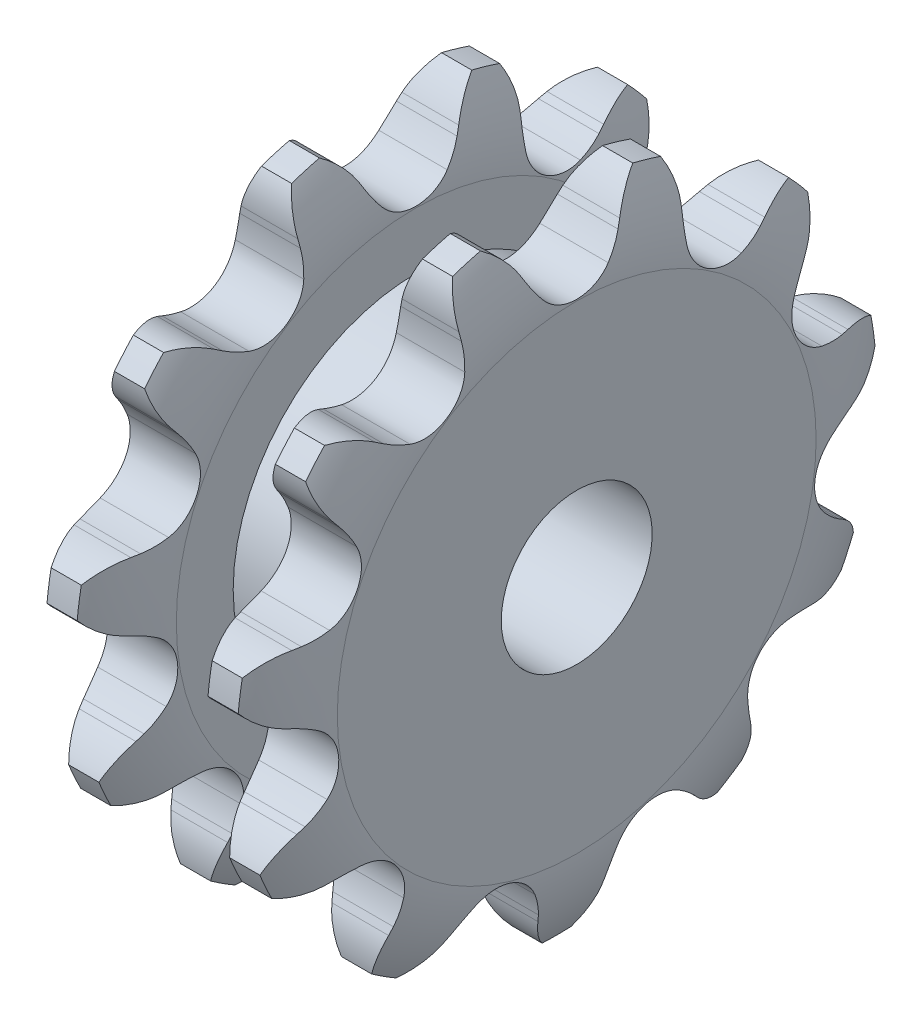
SolidWorks part; units mm, degrees
ref_plane "Plane1" through (0, 0, 0) normal (0, 0, 1) x (1, 0, 0)
ref_plane "Plane2" through (0, 0, 0) normal (0, 1, 0) x (1, 0, 0)
ref_plane "Plane3" through (0, 0, 0) normal (1, 0, 0) x (0, 0, -1)
other "Configuration Table"
sketch "Clipboard" plane through (0, 0, 0) normal (0, 1, 0) x (1, 0, 0)
  line L0 (0, 0) -> (6.2333, -1.2116)
  line L1 (-15, 0) -> (100, 0) construction
  line L2 (0, 0) -> (-0.5301, 0.5991)
  line L3 (0, 0) -> (-2.9891, 1.1425)
  line L4 (0, 0) -> (3.043, 0.5915)
  line L5 (0, 0) -> (-89.0105, -33.1983)
  line L6 (0, 0) -> (-7.6265, -5.1456)
  line L7 (-0.5301, 0.5991) -> (92.0355, 21.9696)
  line L8 (-76.2, 38.1) -> (-75.2, 38.1)
  line L9 (-73.2358, 39.4872) -> (-73.0836, 39.4947)
  line L10 (-73.0533, 76.1892) -> (-66.6533, 76.1892)
  circle A0 centre (0, 0) radius 1.651
  circle A1 centre (0, 0) radius 4
  circle A2 centre (0, 0) radius 4
sketch "BasProSke" plane through (0, 0, 0) normal (0, 1, 0) x (1, 0, 0)
  line L0 (-10, 0) -> (60, 0) construction
  line L1 (0, 0) -> (0, 9.5181)
  line L2 (0, 0) -> (9.2, 0)
  line L3 (9.2, 0) -> (9.2, 9.5181)
  line L4 (8.4, 12.7181) -> (0.8, 12.7181)
  arc A0 (0, 9.5181) -> (0.8, 12.7181) centre (6.8, 9.5181) cw
  arc A1 (9.2, 9.5181) -> (8.4, 12.7181) centre (2.4, 9.5181) ccw
revolve "Base-Revolve" add sketch "BasProSke" angle 360 about L0
sketch "GrvSke" plane through (0, 0, 0) normal (0, 1, 0) x (1, 0, 0)
  line L0 (2.8, 9.5181) -> (2.8, 7.2571)
  line L1 (2.8, 7.2571) -> (6.4, 7.2571)
  line L2 (6.4, 7.2571) -> (6.4, 9.5181)
  line L3 (2, 12.7181) -> (7.2, 12.7181)
  line L4 (4.6, 0) -> (4.6, 52.07) construction
  line L5 (-10, 0) -> (60, 0) construction
  line L6 (0, 0) -> (35.56, 0) construction
  arc A0 (6.4, 9.5181) -> (7.2, 12.7181) centre (13.2, 9.5181) cw
  arc A1 (2.8, 9.5181) -> (2, 12.7181) centre (-4, 9.5181) ccw
revolve "Groove" cut sketch "GrvSke" angle 360 about L6
pattern_linear "Grooves" [suppressed]
sketch "TooCutSke" plane through (0, 0, 0) normal (1, 0, 0) x (0, 0, -1)
  line L0 (1.8371, 10.977) -> (1.9787, 11.2486)
  line L1 (0, 0) -> (0, 107) construction
  line L2 (0, 11.2696) -> (-10, 11.2696) construction
  line L3 (-1.8371, 10.977) -> (-1.9787, 11.2486)
  arc A0 (1.2916, 10.1682) -> (1.8371, 10.977) centre (-2.01, 12.9835) ccw
  arc A1 (1.2916, 10.1682) -> (-1.2916, 10.1682) centre (0, 11.2696) cw
  arc A2 (1.9787, 11.2486) -> (4.4355, 12.7381) centre (4.4355, 9.9672) cw
  arc A3 (-1.2916, 10.1682) -> (-1.8371, 10.977) centre (2.01, 12.9835) cw
  arc A4 (-1.9787, 11.2486) -> (-4.4355, 12.7381) centre (-4.4355, 9.9672) ccw
  arc A5 (4.4355, 12.7381) -> (-4.4355, 12.7381) centre (0, 0) ccw
extrude "ToothCut" cut sketch "TooCutSke" along normal through all
pattern_circular "TeethCuts" count 11 every 32.727 about axis through (-10, 0, 0) along (1, 0, 0) of "ToothCut"
sketch "HubNeaOneSke" plane through (0, 0, 0) normal (-1, 0, 0) x (0, 0, 1)
  circle A0 centre (0, 0) radius 4
extrude "HubNearOne" [suppressed] add sketch "HubNeaOneSke" along normal blind 85.8005
sketch "HubNeaBotSke" plane through (0, 0, 0) normal (-1, 0, 0) x (0, 0, 1)
  circle A0 centre (0, 0) radius 4
extrude "HubNearBoth" [suppressed] add sketch "HubNeaBotSke" along normal blind 42.9002
ref_plane "FarPln" through (9.2, 0, 0) normal (1, 0, 0) x (0, 0, -1)
sketch "HubFarSke" plane through (9.2, 0, 0) normal (1, 0, 0) x (0, 0, -1)
  circle A0 centre (0, 0) radius 4
extrude "HubFar" [suppressed] add sketch "HubFarSke" along normal blind 42.9002
sketch "BorSke" plane through (0, 0, 0) normal (1, 0, 0) x (0, 0, -1)
  circle A0 centre (0, 0) radius 3
extrude "Bore" cut sketch "BorSke" along normal mid plane 190.001
sketch "KeySke" plane through (0, 0, 0) normal (1, 0, 0) x (0, 0, -1)
  line L0 (-1, 0) -> (-1, 4)
  line L1 (-1, 4) -> (1, 4)
  line L2 (1, 4) -> (1, 0)
  line L3 (0, 0) -> (0, 34) construction
  line L4 (-1, 0) -> (1, 0)
extrude "Keyway" [suppressed] cut sketch "KeySke" along normal mid plane 190.001
pattern_circular "Keyway2" [suppressed] count 2 every 90 about axis through (-10, 0, 0) along (1, 0, 0)
equation "' \"Pitch@Clipboard\" = 6.35"
equation "' \"Num_strands@Clipboard\" = 2"
equation "' \"Num_teeth@Clipboard\" = 11"
equation "' \"Hub_dia@Clipboard\" = 8"
equation "' \"Overall_len@Clipboard\" = 95"
equation "' \"Diameter@BorSke\" = 6"
equation "' \"T_dim@Clipboard\" = 1"
equation "' \"Width@KeySke\" = 2"
equation "' \"Dr@Clipboard\" = 3.302"
equation "' \"Face_width@Clipboard\" = 2.8"
equation "' \"Chamfer_dep@Clipboard\" = 3.2"
equation "' \"Chamfer_wid@Clipboard\" = 0.8"
equation "' \"Transv_pitch@Clipboard\" = 6.4"
equation "' \"Show_teeth@Clipboard\" = 11"
equation "\"Num_teeth@Clipboard\" = int( \"Num_teeth@Clipboard\" )"
equation "\"Num_teeth@Clipboard\" = ((sgn( \"Num_teeth@Clipboard\" - 5.0)+1)*( \"Num_teeth@Clipboard\" - 5.0))/2 +5.0"
equation "\"Num_teeth@Clipboard\" = ((sgn( \"Num_teeth@Clipboard\" - 200.0)-1)*( \"Num_teeth@Clipboard\" - 200.0))/-2 +200.0"
equation "\"MHD@Clipboard\" = \"Pitch@Clipboard\" * (1.0 / tan(3.14159265 / \"Num_teeth@Clipboard\" ) - 1.0) - 0.762"
equation "\"Thickness@Clipboard\"  = \"Face_width@Clipboard\" + (\"Num_strands@Clipboard\" - 1) * \"Transv_pitch@Clipboard\""
equation "\"OAL@Clipboard\" = \"Thickness@Clipboard\""
equation "\"MHD@Clipboard\" = ((sgn( \"MHD@Clipboard\" - \"Hub_dia@Clipboard\" )-1)*( \"MHD@Clipboard\" - \"Hub_dia@Clipboard\" ))/-2+ \"Hub_dia@Clipboard\""
equation "\"OAL@Clipboard\" = ((sgn( \"OAL@Clipboard\" - \"Overall_len@Clipboard\" )+1)*( \"OAL@Clipboard\" - \"Overall_len@Clipboard\" ))/2 + \"Overall_len@Clipboard\" + 0.0005"
equation "\"Num_teeth@TeethCuts\" = int( \"Show_teeth@Clipboard\" ) + 1"
equation "\"Num_teeth@TeethCuts\" = ((sgn( \"Num_teeth@TeethCuts\" - \"Num_teeth@Clipboard\" )-1)*( \"Num_teeth@TeethCuts\" - \"Num_teeth@Clipboard\" ))/-2+ \"Num_teeth@Clipboard\""
equation "\"Num_teeth@TeethCuts\" = ((sgn( \"Num_teeth@TeethCuts\" - 2.0)+1)*( \"Num_teeth@TeethCuts\" - 2.0))/2 +2.0"
equation "\"Angle@TeethCuts\" = 360.0 / \"Num_teeth@Clipboard\""
equation "\"Pitch_radius@TooCutSke\" = ( \"Pitch@Clipboard\" / 2.0) / sin(3.14159265 / \"Num_teeth@Clipboard\" )  'ma"
equation "\"R@TooCutSke\"  = \"Dr@Clipboard\" * 0.5025 + 0.0381"
equation "\"A@TooCutSke\" = 35.0 + (60.0 / \"Num_teeth@Clipboard\")"
equation "\"E@TooCutSke\"  = \"Dr@Clipboard\" * 1.3025 + 0.0381"
equation "\"B@TooCutSke\"  = 18.0 - (56.0 / \"Num_teeth@Clipboard\" )"
equation "\"W@TooCutSke\" = 1.4 * \"Dr@Clipboard\" * cos(3.14159265 / \"Num_teeth@Clipboard\" )"
equation "\"V@TooCutSke\" = 1.4 * \"Dr@Clipboard\" * sin(3.14159265 / \"Num_teeth@Clipboard\" )"
equation "\"Diameter@BasProSke\" = 2.0 * ( (0.3 * \"Pitch@Clipboard\" ) +  \"Pitch@Clipboard\" / 2.0 / tan(3.14159265 / \"Num_teeth@Clipboard\" ))"
equation "\"Thickness@BasProSke\"  = \"Thickness@Clipboard\""
equation "\"G1@BasProSke\" =  \"Chamfer_wid@Clipboard\""
equation "\"G2@BasProSke\" =  \"Chamfer_wid@Clipboard\""
equation "\"H1@BasProSke\" =  \"Chamfer_dep@Clipboard\""
equation "\"H2@BasProSke\" =  \"Chamfer_dep@Clipboard\""
equation "\"Diameter@GrvSke\" = \"Diameter@BasProSke\""
equation "\"G1@GrvSke\" = \"Chamfer_wid@Clipboard\""
equation "\"H1@GrvSke\" = \"Chamfer_dep@Clipboard\""
equation "\"Grv_diam@GrvSke\" =  \"Pitch@Clipboard\" * (1.0 / tan(3.14159265 / \"Num_teeth@Clipboard\" ) - 1.0) - 0.762"
equation "\"Grv_width@GrvSke\" =  \"Transv_pitch@Clipboard\" - \"Face_width@Clipboard\""
equation "\"Offset@GrvSke\" = \"Grv_width@GrvSke\" / 2.0 + \"Face_width@Clipboard\""
equation "\"Offset@Grooves\" = \"Transv_pitch@Clipboard\""
equation "\"Num_grvs@Grooves\" = \"Num_strands@Clipboard\""
equation "\"Num_grvs@Grooves\" = \"Num_grvs@Grooves\" - 1 * sgn( \"Num_grvs@Grooves\" -1)"
equation "\"Diameter@HubNeaOneSke\" = \"MHD@Clipboard\""
equation "\"Length@HubNearOne\" = \"OAL@Clipboard\" - \"Thickness@BasProSke\""
equation "\"Diameter@HubNeaBotSke\" = \"MHD@Clipboard\""
equation "\"Length@HubNearBoth\" = ( \"OAL@Clipboard\" - \"Thickness@BasProSke\" ) / 2.0"
equation "\"Thickness@FarPln\" = \"Thickness@BasProSke\""
equation "\"Diameter@HubFarSke\" = \"MHD@Clipboard\""
equation "\"Length@HubFar\" = ( \"OAL@Clipboard\" - \"Thickness@BasProSke\" ) / 2.0"
equation "\"D1@Bore\" = \"OAL@Clipboard\" * 2.0"
equation "\"D1@Keyway\" = \"OAL@Clipboard\" * 2.0"
equation "\"Offset@KeySke\" = \"T_dim@Clipboard\" + \"Diameter@BorSke\" / 2.0"
